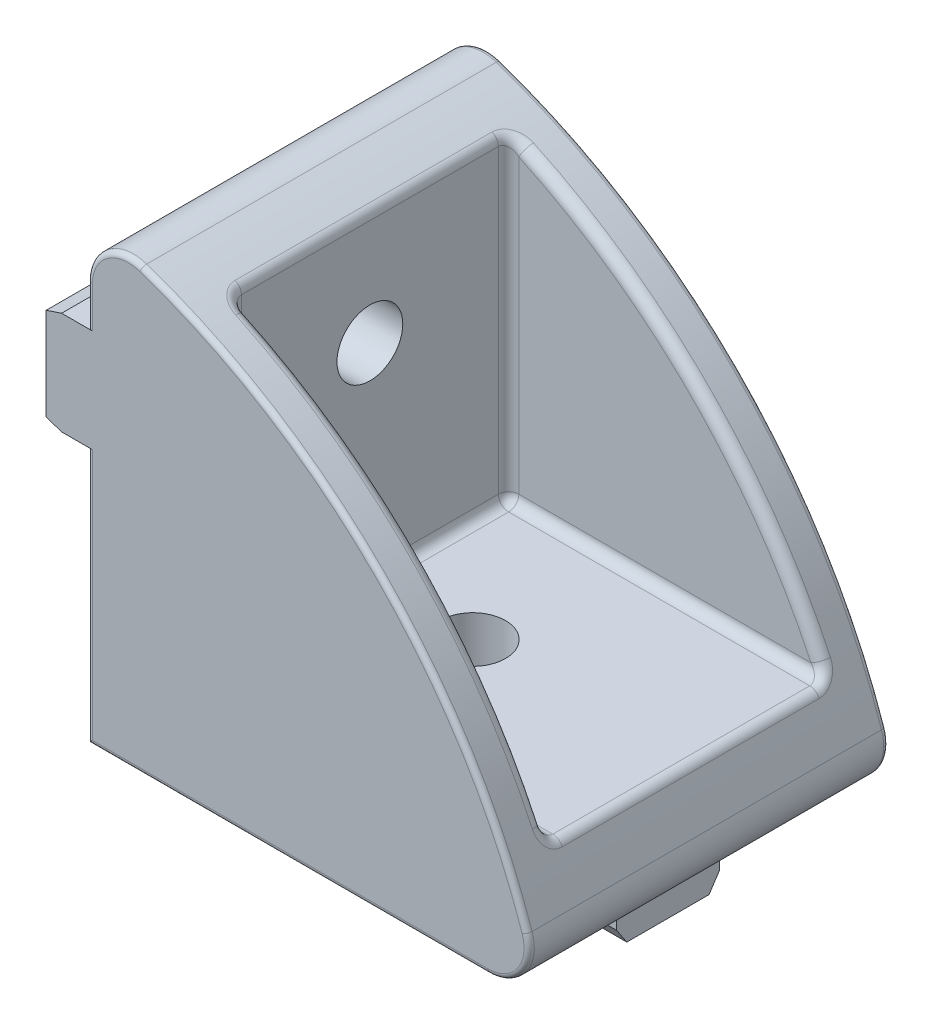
SolidWorks part; units mm, degrees
ref_plane "Plan de face" through (0, 0, 0) normal (0, 0, 1) x (1, 0, 0)
ref_plane "Plan de dessus" through (0, 0, 0) normal (0, 1, 0) x (1, 0, 0)
ref_plane "Plan de droite" through (0, 0, 0) normal (1, 0, 0) x (0, 0, -1)
sketch "Esquisse1" plane through (0, 0, 0) normal (0, 0, 1) x (1, 0, 0)
  line L0 (0, 39) -> (0, 35)
  line L1 (0, 0) -> (39, 0)
  line L2 (4, 39) -> (4, 4) construction
  line L3 (4, 4) -> (39, 4) construction
  line L4 (0, 35) -> (-2.5, 35)
  line L5 (-2.5, 35) -> (-4, 34.5)
  line L6 (-4, 34.5) -> (-4, 25.5)
  line L9 (7.0096, 30) -> (-15.3159, 30) construction
  line L10 (0, 25) -> (0, 0)
  line L11 (-2.5, 25) -> (-4, 25.5)
  line L12 (0, 25) -> (-2.5, 25)
  arc A4 (5.2872, 42.7872) -> (0, 39) centre (4, 39) ccw
  arc A5 (42.7872, 5.2872) -> (39, 0) centre (39, 4) cw
  arc A6 (5.2872, 42.7872) -> (42.7872, 5.2872) centre (-14.0211, -14.0211) cw
  point P16 (-4, 30)
  dimension "D1" = 4
  dimension "D2" = 4
  dimension "D3" = 60
  dimension "D4" = 30
  dimension "D5" = 10
  dimension "D6" = 9
  dimension "D7" = 1.5
  dimension "D8" = 4
  dimension "D9" = 35
extrude "Boss.-Extru.1" add sketch "Esquisse1" along normal mid plane 35
shell "Coque1" thickness 10
sketch "Esquisse2" plane through (0, 0, 0) normal (-1, 0, 0) x (0, 0, 1)
  line L0 (-5, 0) -> (-5, -2.5)
  line L1 (17.5, 0) -> (-17.5, 0) construction
  line L2 (-5, -2.5) -> (-4, -4)
  line L3 (-4, -4) -> (4, -4)
  line L4 (-5, 0) -> (5, 0)
  line L5 (0, 0) -> (0, -13.4746) construction
  line L6 (5, -2.5) -> (4, -4)
  line L7 (5, 0) -> (5, -2.5)
  point P11 (0, 0)
  point P12 (0, -4)
  dimension "D1" = 10
  dimension "D2" = 8
  dimension "D3" = 4
  dimension "D4" = 1.5
extrude "Boss.-Extru.2" add sketch "Esquisse2" against normal up to vertex
fillet "Congé1" radius 1 9 edges at (10, 25.4803, -13.5) (10, 25.4803, 13.5) (25.4803, 10, 13.5) (10, 10, 0) (25.4803, 10, -13.5) (28.4053, 28.4053, 13.5) (28.4053, 28.4053, -13.5) (10, 40.9606, 0) (40.9606, 10, 0)
sketch "Esquisse3" plane through (-4, 0, 0) normal (-1, 0, 0) x (0, 0, 1)
  line L0 (17.5, 34.5) -> (17.5, 25.5) construction
  line L1 (17.5, 25.5) -> (-17.5, 25.5) construction
  circle A0 centre (0, 30) radius 3.2
  point P4 (17.5, 30)
  point P7 (0, 25.5)
  dimension "D1" = 6.4
extrude "Enlèv. mat.-Extru.1" cut sketch "Esquisse3" against normal through all
sketch "Esquisse4" plane through (0, -4, 0) normal (0, -1, 0) x (1, 0, 0)
  circle A0 centre (20, 0) radius 3.2
  point P2 (0, 0)
  point P4 (0, 0)
  dimension "D1" = 6.4
  dimension "D2" = 20
extrude "Enlèv. mat.-Extru.2" cut sketch "Esquisse4" against normal through all
fillet "Congé2" radius 0.5 12 edges at (19.5, 0, -17.5) (0, 37, -17.5) (42.2518, 1.6707, -17.5) (19.5, 0, 17.5) (0, 37, 17.5) (42.2518, 1.6707, 17.5) (0, 12.5, -17.5) (0, 12.5, 17.5) (1.6707, 42.2518, -17.5) (1.6707, 42.2518, 17.5) (28.4053, 28.4053, -17.5) (28.4053, 28.4053, 17.5)
